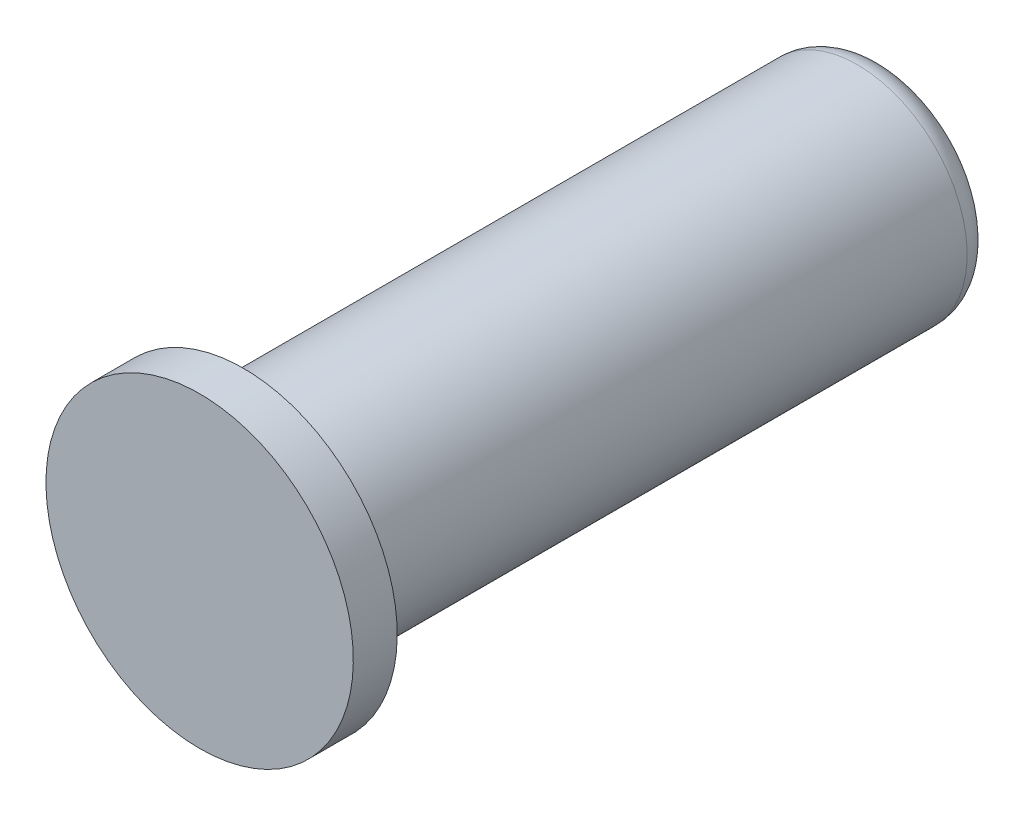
SolidWorks part; units mm, degrees
ref_plane "Front Plane" through (0, 0, 0) normal (0, 0, 1) x (1, 0, 0)
ref_plane "Top Plane" through (0, 0, 0) normal (0, 1, 0) x (1, 0, 0)
ref_plane "Right Plane" through (0, 0, 0) normal (1, 0, 0) x (0, 0, -1)
sketch "Sketch1" plane through (0, 0, 0) normal (1, 0, 0) x (0, 0, -1)
  line L0 (0, 0) -> (37.7, 0) construction
  line L1 (0, 0) -> (0, 17.5)
  line L2 (0, 17.5) -> (5, 17.5)
  line L3 (5, 17.5) -> (5, 12.5)
  line L4 (5, 12.5) -> (74.9, 12.5)
  line L5 (77.9, 9.5) -> (77.9, 4.5)
  line L6 (77.4, 4) -> (68.9, 4)
  line L7 (68.9, 4) -> (66.5906, 0)
  line L8 (77.4, 4) -> (77.9, 4.5)
  line L9 (0, 0) -> (66.5906, 0)
  arc A0 (74.9, 12.5) -> (77.9, 9.5) centre (74.9, 9.5) cw
  point P13 (77.9, 12.5)
  dimension "D3" = 3
  dimension "D1" = 72.9
  dimension "D2" = 5
  dimension "D4" = 17.5
  dimension "D5" = 45
  dimension "D6" = 0.5
  dimension "D7" = 9
  dimension "D8" = 60
  dimension "D9" = 4
  dimension "D10" = 12.5
revolve "Revolve1" add sketch "Sketch1" angle 360 about L0
